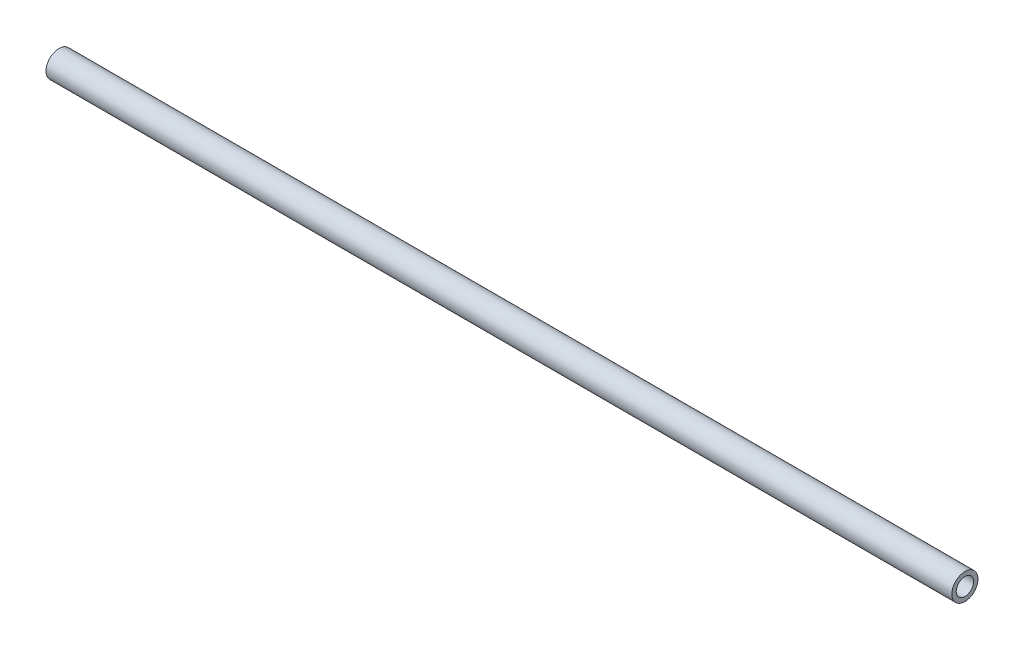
SolidWorks part; units mm, degrees
ref_plane "Front Plane" through (0, 0, 0) normal (0, 0, 1) x (1, 0, 0)
ref_plane "Top Plane" through (0, 0, 0) normal (0, 1, 0) x (1, 0, 0)
ref_plane "Right Plane" through (0, 0, 0) normal (1, 0, 0) x (0, 0, -1)
sketch "Sketch1" plane through (0, 0, 0) normal (1, 0, 0) x (0, 0, -1)
  circle A0 centre (0, 0) radius 4.7625
  circle A1 centre (0, 0) radius 3.175
  dimension "D1" = 9.525
  dimension "D2" = 6.35
extrude "Boss-Extrude1" add sketch "Sketch1" along normal blind 330.2
